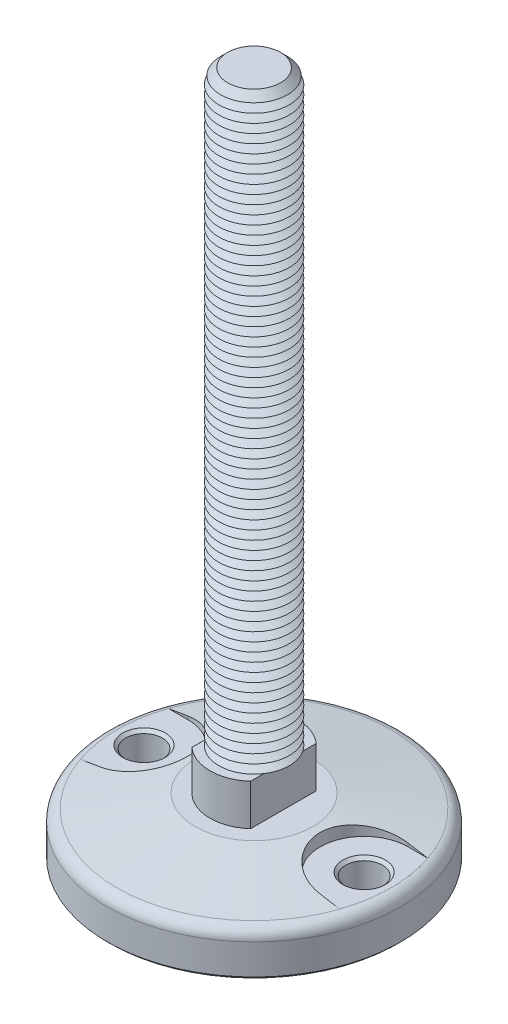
SolidWorks part; units mm, degrees
ref_plane "Front Plane" through (0, 0, 0) normal (0, 0, 1) x (1, 0, 0)
ref_plane "Top Plane" through (0, 0, 0) normal (0, 1, 0) x (1, 0, 0)
ref_plane "Right Plane" through (0, 0, 0) normal (1, 0, 0) x (0, 0, -1)
sketch "Sketch1" plane through (0, 0, 0) normal (1, 0, 0) x (0, 0, -1)
  line L0 (0, 61.3389) -> (0, -58.404) construction
sketch "Sketch2" plane through (0, 0, 0) normal (1, 0, 0) x (0, 0, -1)
  line L0 (0, 0) -> (-20, 0)
  line L1 (-20, 0) -> (-50, -5.2898)
  line L2 (-50, -5.2898) -> (-50, -20)
  line L3 (-50, -20) -> (0, -20)
  line L4 (0, 61.3389) -> (0, -58.404) construction
  line L5 (0, -20) -> (0, 0)
  dimension "D1" = 20
  dimension "D2" = 50
  dimension "D3" = 20
  dimension "D4" = 10
revolve "Revolve1" add sketch "Sketch2" angle 360 about L0
fillet "Fillet1" radius 4 1 edges at (0, -5.2898, 50)
sketch "Sketch3" plane through (0, 0, 0) normal (0, 1, 0) x (1, 0, 0)
  circle A0 centre (0, 0) radius 15
  dimension "D1" = 30
extrude "Boss-Extrude1" add sketch "Sketch3" along normal blind 14
sketch "Sketch4" plane through (0, 14, 0) normal (0, 1, 0) x (1, 0, 0)
  line L0 (-10, 11.1803) -> (-10, -11.1803)
  line L2 (10, -11.1803) -> (10, 11.1803)
  arc A0 (-10, 11.1803) -> (-10, -11.1803) centre (0, 0) ccw
  circle A1 centre (0, 0) radius 15 construction
  arc A2 (10, -11.1803) -> (10, 11.1803) centre (0, 0) ccw
  dimension "D1" = 20
extrude "Cut-Extrude1" cut sketch "Sketch4" against normal blind 14
sketch "Sketch5" plane through (0, 14, 0) normal (0, 1, 0) x (1, 0, 0)
  circle A0 centre (0, 0) radius 12
  dimension "D1" = 24
extrude "Boss-Extrude2" add sketch "Sketch5" along normal blind 200
chamfer "Chamfer1" distance 3 angle 45 1 edges at (0, 214, 12)
sketch "Sketch6" plane through (0, 0, 0) normal (1, 0, 0) x (0, 0, -1)
  line L0 (-12, 14) -> (-9.4019, 15.5)
  line L1 (-9.4019, 15.5) -> (-12, 17)
  line L2 (-12, 211) -> (-12, 14) construction
  line L3 (-12, 17) -> (-12, 14)
  dimension "D1" = 3
revolve "Cut-Revolve1" cut sketch "Sketch6" angle 360 about L0
pattern_linear "LPattern1" count 66 spacing 3 along (0, 1, 0) of "Cut-Revolve1"
sketch "Sketch8" plane through (0, 0, 0) normal (0, 1, 0) x (1, 0, 0)
  line L0 (-37.5, 15) -> (-44.2197, 15)
  line L1 (-37.5, -15) -> (-44.2197, -15)
  arc A1 (-44.2197, 15) -> (-44.2197, -15) centre (0, 0) ccw
  circle A2 centre (0, 0) radius 46.6946 construction
  arc A3 (-37.5, -15) -> (-37.5, 15) centre (-37.5, 0) ccw
  point P3 (-37.5, 0)
  point P11 (0, 0)
  dimension "D1" = 37.5
  dimension "D2" = 30
extrude "Cut-Extrude4" cut sketch "Sketch8" against normal blind 4.7
sketch "Sketch10" plane through (0, -4.7, 0) normal (0, 1, 0) x (1, 0, 0)
  circle A0 centre (-37.5, 0) radius 6.25
  dimension "D1" = 12.5
extrude "Cut-Extrude5" cut sketch "Sketch10" against normal up to surface (15.3 mm away)
chamfer "Chamfer2" distance 1 angle 45 2 edges at (-37.5, -20, -6.25) (-37.5, -4.7, 6.25)
mirror "Mirror1" about plane through (0, 0, 0) normal (1, 0, 0) of "Chamfer2", "Cut-Extrude5", "Cut-Extrude4"
chamfer "Chamfer3" distance 1 angle 45 1 edges at (0, -20, 50)
